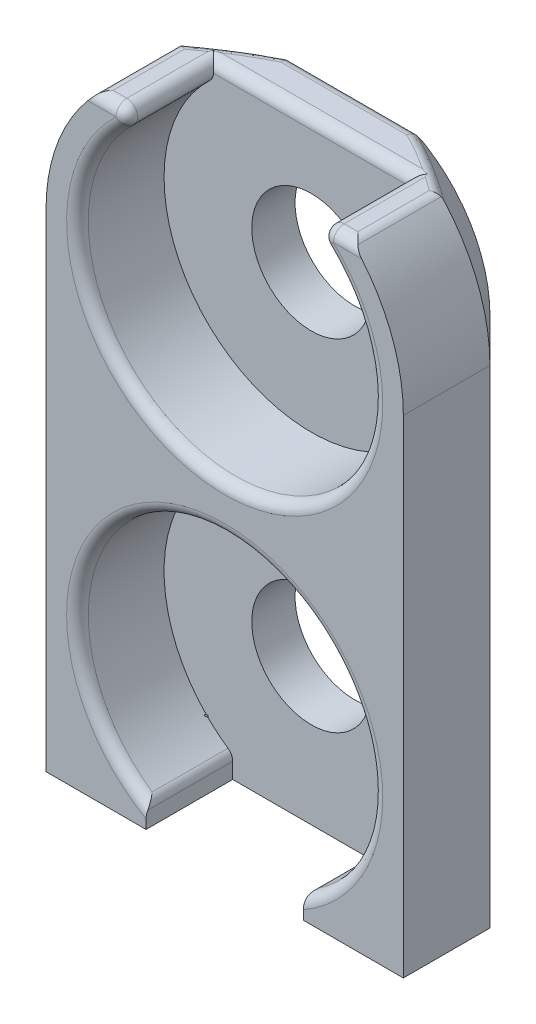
SolidWorks part; units mm, degrees
ref_plane "Plano frontal" through (0, 0, 0) normal (0, 0, 1) x (1, 0, 0)
ref_plane "Plano superior" through (0, 0, 0) normal (0, 1, 0) x (1, 0, 0)
ref_plane "Plano direito" through (0, 0, 0) normal (1, 0, 0) x (0, 0, -1)
sketch "Esboço1" plane through (0, 0, 0) normal (0, 0, 1) x (1, 0, 0)
  line L2 (-16.5, 0) -> (-16.5, 45)
  line L3 (16.5, 45) -> (16.5, 0)
  line L7 (0, 0) -> (0, 13.5) construction
  line L8 (0, 13.5) -> (0, 45) construction
  line L10 (-16.5, 0) -> (16.5, 0)
  arc A0 (-16.5, 45) -> (16.5, 45) centre (0, 45) cw
  circle A1 centre (0, 13.5) radius 9 construction
  circle A2 centre (0, 45) radius 9 construction
  circle A3 centre (0, 45) radius 5.5
  circle A4 centre (0, 13.5) radius 5.5
  dimension "D5" = 18
  dimension "D7" = 18
  dimension "D8" = 11
  dimension "D9" = 11
  dimension "D1" = 33
  dimension "D4" = 13.5
  dimension "D6" = 31.5
extrude "Ressalto-extrusão2" add sketch "Esboço1" along normal blind 12
sketch "Esboço2" plane through (0, 0, 12) normal (0, 0, 1) x (1, 0, 0)
  circle A0 centre (0, 45) radius 13.6
  circle A1 centre (0, 13.5) radius 13.6
  dimension "D1" = 27.2
  dimension "D2" = 27.2
extrude "Corte-extrusão1" cut sketch "Esboço2" against normal blind 8
sketch "Esboço3" plane through (0, 0, 0) normal (0, -1, 0) x (-1, 0, 0)
  line L0 (16.5, -3) -> (-16.5, -3) construction
  line L4 (16.5, -12) -> (16.5, 0) construction
  line L5 (-16.5, -12) -> (-16.5, 0) construction
  line L6 (-16.5, -9) -> (16.5, -9) construction
  line L7 (16.5, -12) -> (1.6462, -12) construction
  circle A0 centre (-11, -3) radius 1.75
  circle A1 centre (-14, -9) radius 1.75
  circle A2 centre (14, -9) radius 1.75
  circle A3 centre (11, -3) radius 1.75
  point P2 (-14, -9)
  point P3 (14, -9)
  point P6 (11, -3)
  point P7 (-11, -3)
  dimension "D7" = 3.5
  dimension "D1" = 3
  dimension "D2" = 22
  dimension "D3" = 11
  dimension "D4" = 3
  dimension "D5" = 28
  dimension "D6" = 14
sketch "Esboço5" plane through (0, 0, 12) normal (0, 0, 1) x (1, 0, 0)
  line L4 (-7.2602, 0) -> (-7.2602, 2)
  line L5 (-16.5, 0) -> (-1.6462, 0) construction
  line L6 (7.2602, 0) -> (7.2602, 2)
  line L7 (-7.2602, 0) -> (7.2602, 0)
  line L8 (-7.2602, 2) -> (7.2602, 2)
  circle A3 centre (0, 13.5) radius 13.6 construction
  dimension "D2" = 2
extrude "Corte-extrusão2" cut sketch "Esboço5" against normal up to surface (8 mm away)
sketch "Esboço6" plane through (0, 0, 12) normal (0, 0, 1) x (1, 0, 0)
  line L0 (-11.7341, 56.6) -> (11.7341, 56.6)
  line L1 (-11.7341, 56.6) -> (-11.7341, 61.5)
  line L2 (-11.7341, 61.5) -> (11.7341, 61.5)
  line L3 (11.7341, 61.5) -> (11.7341, 56.6)
  line L4 (0, 56.6) -> (0, 58.6) construction
  arc A1 (16.5, 45) -> (-16.5, 45) centre (0, 45) ccw construction
  circle A3 centre (0, 45) radius 13.6 construction
  point P3 (0, 56.6)
  dimension "D1" = 2
extrude "Corte-extrusão8" cut sketch "Esboço6" against normal through all contours L3 L0 L1 L2
extrude "Corte-extrusão9" cut sketch "Esboço3" against normal blind 4
chamfer "Chanfro1" distance 4 angle 45 4 edges at (-16.5, 22.5, 0) (-15.2621, 51.2704, 0) (15.2621, 51.2704, 0) (16.5, 22.5, 0)
fillet "Filete1" radius 1 10 edges at (11.7341, 56.6, 8) (-9.4167, 56.6, 12) (9.4167, 56.6, 12) (7.0993, 56.6, 8) (-7.0993, 56.6, 8) (-11.7341, 56.6, 8) (0, 56.6, 0) (0, 56.6, 4)
fillet "Filete2" radius 1 6 edges at (9.3328, 56.3071, 11.7071) (-9.3328, 56.3071, 11.7071) (0, 31.4, 12) (0, 27.1, 12) (7.2602, 2, 8) (-7.2602, 2, 8)
